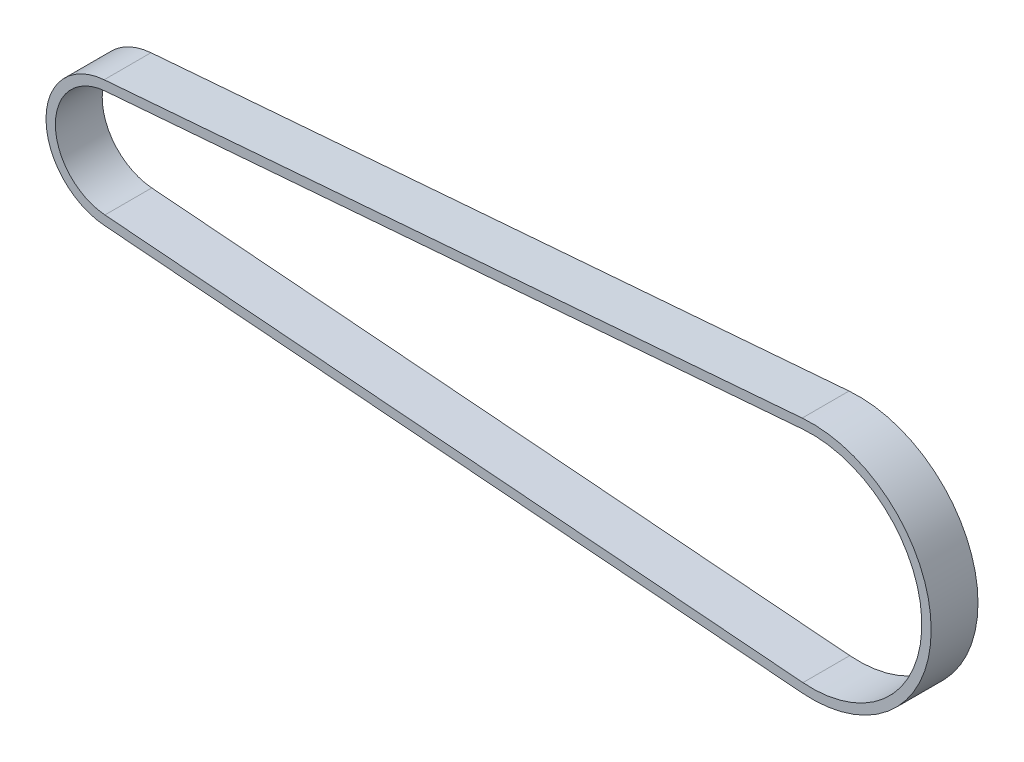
SolidWorks part; units mm, degrees
ref_plane "正面" through (0, 0, 0) normal (0, 0, 1) x (1, 0, 0)
ref_plane "平面" through (0, 0, 0) normal (0, 1, 0) x (1, 0, 0)
ref_plane "右側面" through (0, 0, 0) normal (1, 0, 0) x (0, 0, -1)
sketch "layout" plane through (0, 0, 0) normal (0, 0, 1) x (1, 0, 0)
  line L0 (0, 0) -> (-150, 0) construction
  circle A0 centre (0, 0) radius 23.5
  circle A1 centre (-150, 0) radius 11.5
  dimension "D2" = 47
  dimension "D3" = 23
  dimension "D1" = 150
sketch "ｽｹｯﾁ2" plane through (0, 0, 0) normal (0, 0, 1) x (1, 0, 0)
  line L0 (-150.92, 11.4631) -> (-1.88, 23.4247)
  line L1 (-150.92, -11.4631) -> (-1.88, -23.4247)
  circle A1 centre (-150, 0) radius 11.5
  arc A2 (-150.92, 11.4631) -> (-150.92, -11.4631) centre (-150, 0) ccw
  circle A3 centre (0, 0) radius 23.5
  arc A4 (-1.88, -23.4247) -> (-1.88, 23.4247) centre (0, 0) ccw
  dimension "D1" = 0
  dimension "D2" = 0
extrude "押し出し-薄板1" add sketch "ｽｹｯﾁ2" along normal blind 10 thin
